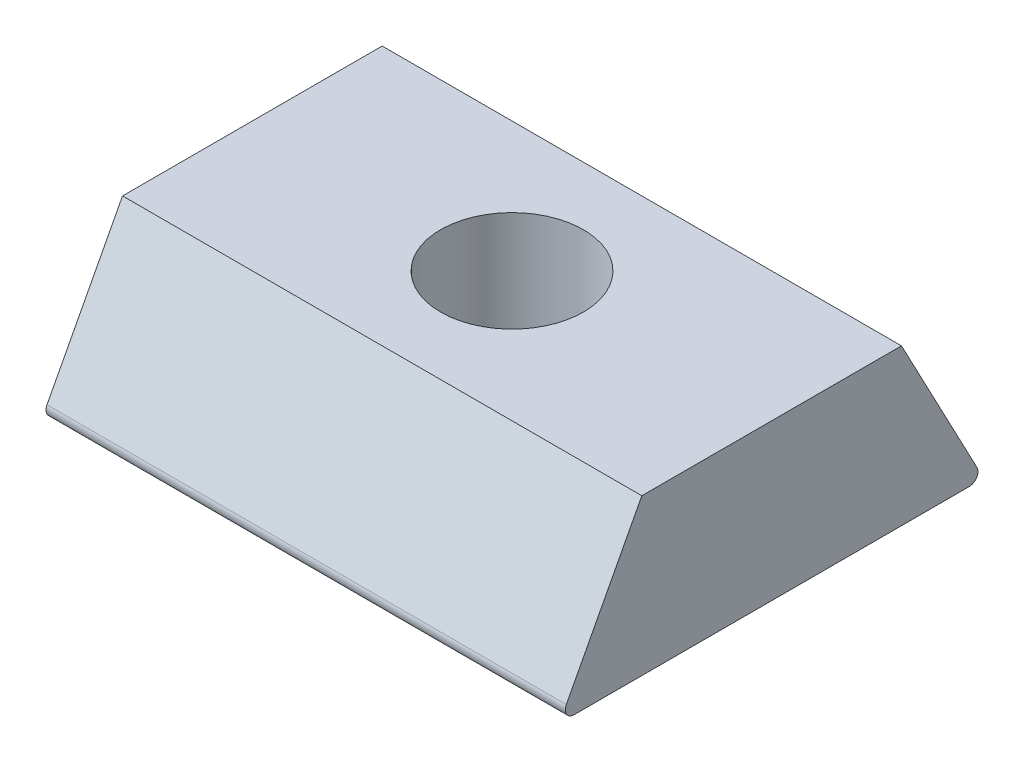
SolidWorks part; units mm, degrees
ref_plane "前视基准面" through (0, 0, 0) normal (0, 0, 1) x (1, 0, 0)
ref_plane "上视基准面" through (0, 0, 0) normal (0, 1, 0) x (1, 0, 0)
ref_plane "右视基准面" through (0, 0, 0) normal (1, 0, 0) x (0, 0, -1)
sketch "草图1" plane through (0, 0, 0) normal (0, 1, 0) x (1, 0, 0)
  line L1 (-6, 4.9) -> (6, 4.9)
  line L2 (-6, 4.9) -> (-6, -4.9)
  line L3 (-6, -4.9) -> (6, -4.9)
  line L4 (6, 4.9) -> (6, -4.9)
  line L5 (-6, 4.9) -> (6, -4.9) construction
  line L6 (-6, -4.9) -> (6, 4.9) construction
  point P0 (0, 0)
  dimension "D1" = 9.8
  dimension "D2" = 12
extrude "凸台-拉伸1" add sketch "草图1" along normal blind 3.6
sketch "草图3" plane through (6, 0, 0) normal (1, 0, 0) x (0, 0, -1)
  line L0 (-4.9, 0) -> (-3, 3.6)
  line L1 (-4.9, 3.6) -> (4.9, 3.6) construction
  line L2 (-4.9, 3.6) -> (-4.9, 0) construction
  dimension "D1" = 1.9
extrude "切除-拉伸1" cut sketch "草图3" against normal through all
sketch "草图4" plane through (6, 0, 0) normal (1, 0, 0) x (0, 0, -1)
  line L0 (4.9, 0) -> (3, 3.6)
  line L1 (-3, 3.6) -> (4.9, 3.6) construction
  line L2 (4.9, 3.6) -> (4.9, 0) construction
  dimension "D1" = 1.9
extrude "切除-拉伸2" cut sketch "草图4" against normal through all and the other way through all flip side to cut
hole_wizard "M4 螺纹孔1" positions "草图5" profile "草图6" tap size "M4" standard "GB"
sketch "草图5" plane through (0, 3.6, 0) normal (0, 1, 0) x (1, 0, 0)
  point P0 (0, 0)
sketch "草图6" plane through (0, 3.6, 0) normal (1, 0, 0) x (0, 0, 1)
  line L0 (0, 0) -> (0, 3.6)
  line L1 (0, 3.6) -> (1.65, 3.6)
  line L2 (1.65, 3.6) -> (1.65, 0)
  line L5 (1.65, 0) -> (0, 0)
  line L11 (0, -6.35) -> (0, 107.95) construction
  dimension "通孔螺纹孔钻头直径" = 3.3
  dimension "通孔螺纹孔钻头深度" = 3.6
fillet "圆角1" radius 0.2 2 edges at (0, 0, -4.9) (0, 0, 4.9)
